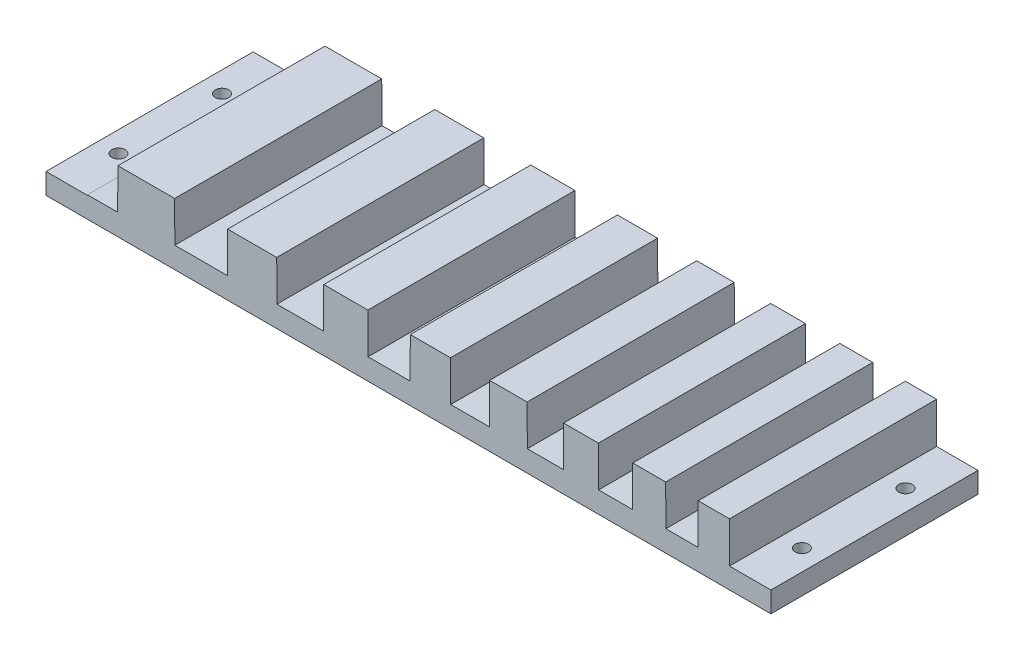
SolidWorks part; units mm, degrees
ref_plane "Front Plane" through (0, 0, 0) normal (0, 0, 1) x (1, 0, 0)
ref_plane "Top Plane" through (0, 0, 0) normal (0, 1, 0) x (1, 0, 0)
ref_plane "Right Plane" through (0, 0, 0) normal (1, 0, 0) x (0, 0, -1)
sketch "Model"
  dimension "D1" = 20
  dimension "D2" = 10
  dimension "D3" = 350
extrude "Boss-Extrude1" add sketch "Model" along normal blind 100
sketch "Sketch2" plane through (0, -10, 0) normal (0, -1, 0) x (1, 0, 0)
  line L0 (155, 100) -> (155, 0) construction
  line L1 (-20, 100) -> (330, 100) construction
  line L2 (-20, 0) -> (330, 0) construction
  line L4 (330, 100) -> (330, 0) construction
  line L5 (330, 50) -> (-20, 50) construction
  line L6 (-20, 100) -> (-20, 0) construction
  circle A0 centre (-10, 75) radius 3.25
  circle A1 centre (-10, 25) radius 3.25
  circle A2 centre (320, 25) radius 3.25
  circle A3 centre (320, 75) radius 3.25
  dimension "D1" = 6.5
  dimension "D2" = 25
  dimension "D3" = 10
extrude "Cut-Extrude1" cut sketch "Sketch2" against normal through all both and the other way through all
